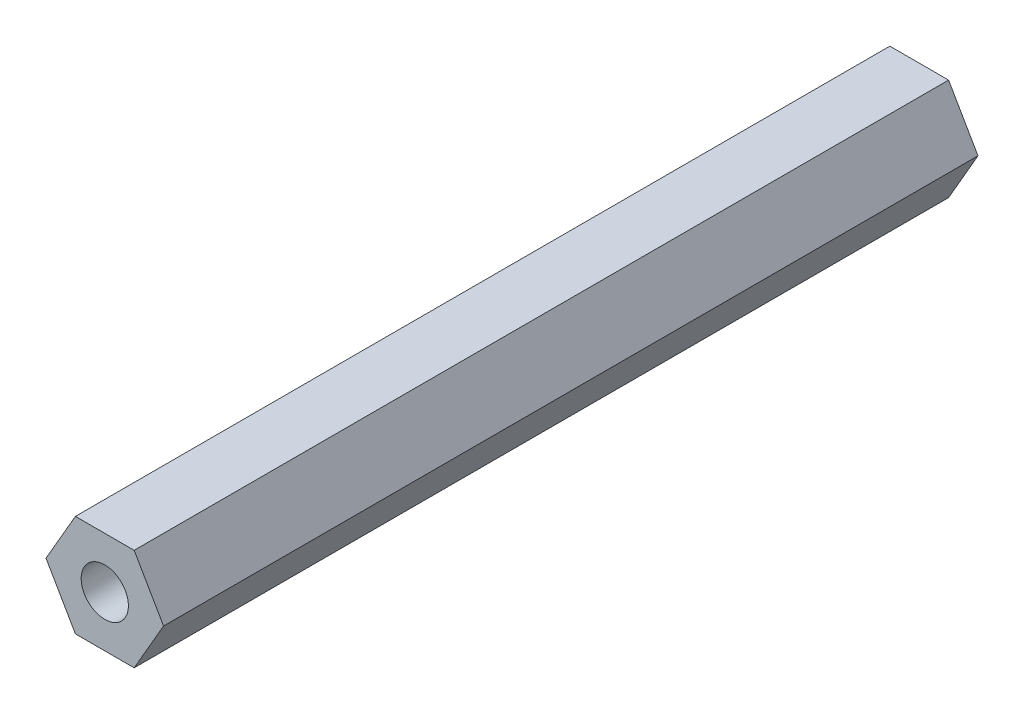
SolidWorks part; units mm, degrees
ref_plane "Front Plane" through (0, 0, 0) normal (0, 0, 1) x (1, 0, 0)
ref_plane "Top Plane" through (0, 0, 0) normal (0, 1, 0) x (1, 0, 0)
ref_plane "Right Plane" through (0, 0, 0) normal (1, 0, 0) x (0, 0, -1)
sketch "Sketch1" plane through (0, 0, 0) normal (0, 0, 1) x (1, 0, 0)
  line L1 (1.8331, 3.175) -> (-1.8331, 3.175)
  line L2 (-1.8331, 3.175) -> (-3.6662, 0)
  line L3 (-3.6662, 0) -> (-1.8331, -3.175)
  line L4 (-1.8331, -3.175) -> (1.8331, -3.175)
  line L5 (1.8331, -3.175) -> (3.6662, 0)
  line L6 (3.6662, 0) -> (1.8331, 3.175)
  circle A0 centre (0, 0) radius 3.175 construction
  dimension "D1" = 6.35
extrude "Boss-Extrude1" add sketch "Sketch1" along normal blind 50.8
hole_wizard "#4 Clearance Hole1" positions "Sketch3" profile "Sketch2" hole size "#4" standard "ANSI Inch"
sketch "Sketch3" plane through (0, 0, 50.8) normal (0, 0, 1) x (1, 0, 0)
  point P0 (0, 0)
sketch "Sketch2" plane through (0, 0, 50.8) normal (1, 0, 0) x (0, -1, 0)
  line L0 (0, 0) -> (0, 50.8)
  line L1 (0, 50.8) -> (1.4732, 50.8)
  line L2 (1.4732, 50.8) -> (1.4732, 0)
  line L5 (1.4732, 0) -> (0, 0)
  line L11 (0, -6.35) -> (0, 107.95) construction
  dimension "Thru Hole Dia." = 2.9464
  dimension "Thru Hole Depth" = 50.8
